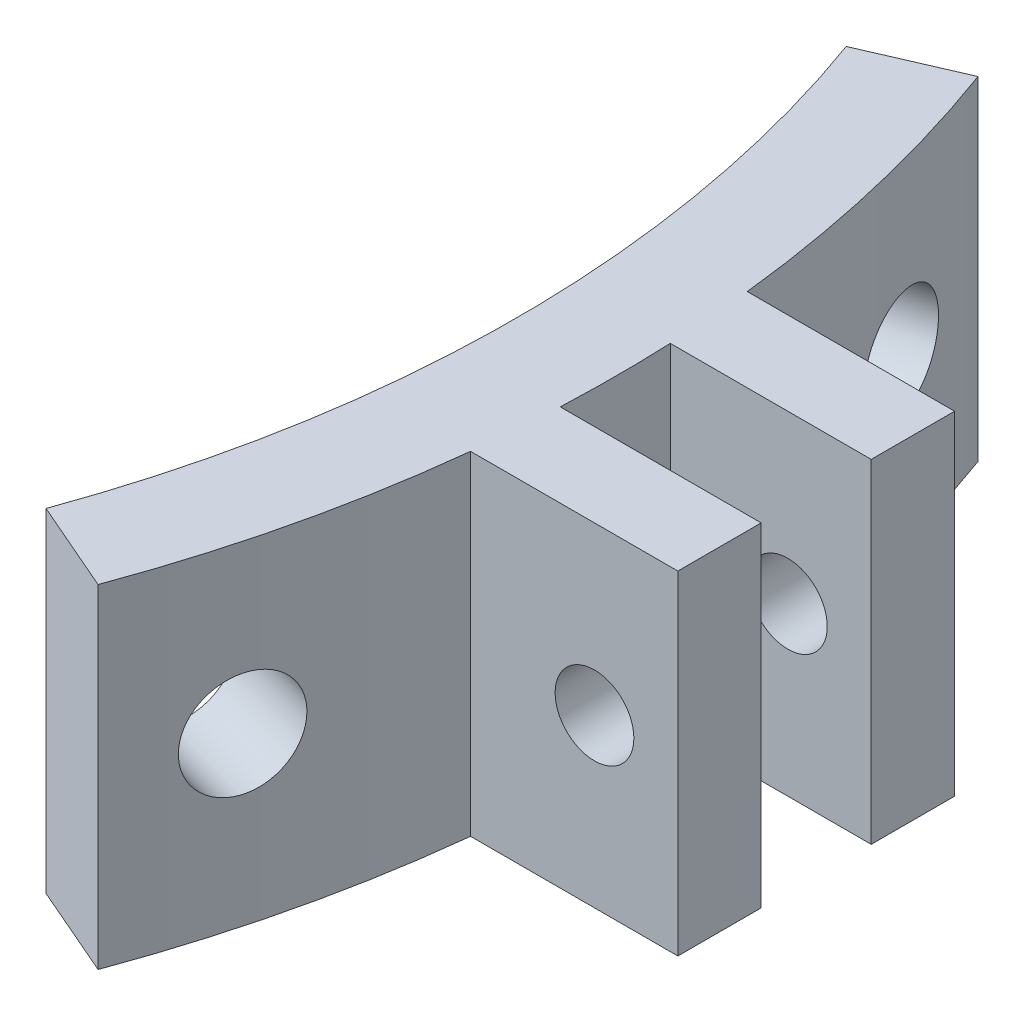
SolidWorks part; units mm, degrees
ref_plane "Front Plane" through (0, 0, 0) normal (0, 0, 1) x (1, 0, 0)
ref_plane "Top Plane" through (0, 0, 0) normal (0, 1, 0) x (1, 0, 0)
ref_plane "Right Plane" through (0, 0, 0) normal (1, 0, 0) x (0, 0, -1)
sketch "Sketch1" plane through (0, 0, 0) normal (0, 1, 0) x (1, 0, 0)
  circle A0 centre (0, 0) radius 44.704
  circle A1 centre (0, 0) radius 48.514
  dimension "D1" = 89.408
  dimension "D2" = 3.81
extrude "Boss-Extrude1" add sketch "Sketch1" along normal mid plane 12.7
sketch "Sketch2" plane through (0, 0, 0) normal (0, 1, 0) x (1, 0, 0)
  line L0 (48.4687, -2.0955) -> (56.1229, -2.0955)
  line L1 (56.1229, -2.0955) -> (56.1229, -5.2705)
  line L2 (56.1229, -5.2705) -> (48.2269, -5.2705)
  circle A0 centre (0, 0) radius 48.514 construction
  arc A1 (48.4687, -2.0955) -> (48.2269, -5.2705) centre (0, 0) cw
  point P4 (48.514, 0)
  dimension "D1" = 3.175
  dimension "D2" = 2.0955
extrude "Boss-Extrude2" add sketch "Sketch2" along normal mid plane 12.7
mirror "Mirror2" about plane through (0, 0, 0) normal (0, 0, 1) of "Boss-Extrude2"
sketch "Sketch4" plane through (0, 0, 0) normal (0, 0, 1) x (1, 0, 0)
  line L0 (56.1229, 6.35) -> (56.1229, -6.35) construction
  line L1 (48.2269, 6.35) -> (56.1229, 6.35) construction
  circle A0 centre (52.9479, 0) radius 1.5
  dimension "D1" = 3
  dimension "D2" = 3.175
  dimension "D3" = 6.35
extrude "Cut-Extrude1" cut sketch "Sketch4" against normal through all both and the other way through all
pattern_circular "CirPattern1" count 4 over 360 about axis through (0, 0, 0) along (0, 1, 0) of "Boss-Extrude2", "Cut-Extrude1"
sketch "Sketch5" plane through (0, 0, 0) normal (0, 1, 0) x (1, 0, 0)
  line L0 (42.0261, 15.24) -> (53.6784, 20.2911)
  line L1 (42.0261, -15.24) -> (53.6784, -20.2911)
  arc A0 (42.0261, 15.24) -> (42.0261, -15.24) centre (0, 0) ccw
  circle A1 centre (0, 0) radius 44.704 construction
  arc A2 (53.6784, 20.2911) -> (53.6784, -20.2911) centre (0, 0) ccw
  dimension "D1" = 15.24
  dimension "D2" = 15.24
  dimension "D3" = 12.7
extrude "Cut-Extrude2" cut sketch "Sketch5" against normal through all both and the other way through all
sketch "Sketch6" plane through (0, 0, 0) normal (0, 1, 0) x (1, 0, 0)
  line L0 (0, 0) -> (46.8609, -12.5563)
  line L2 (0, 0) -> (12.5501, 0) construction
  line L3 (45.9732, -15.8693) -> (47.7486, -9.2434)
  arc A1 (45.5278, -16.758) -> (48.2269, -5.2705) centre (0, 0) ccw construction
  point P12 (46.8609, -12.5563)
  dimension "D1" = 15
ref_plane "Plane1" through (46.8609, 0, 12.5563) normal (0.9659, 0, 0.2588) x (0.2588, 0, -0.9659)
sketch "Sketch7" plane through (46.8609, 0, 12.5563) normal (0.9659, 0, 0.2588) x (0.2588, 0, -0.9659)
  circle A0 centre (0, 0) radius 2
  dimension "D1" = 4
extrude "Cut-Extrude3" cut sketch "Sketch7" against normal up to surface (3.8548 mm away)
mirror "Mirror1" about plane through (0, 0, 0) normal (0, 0, 1) of "Cut-Extrude3"
